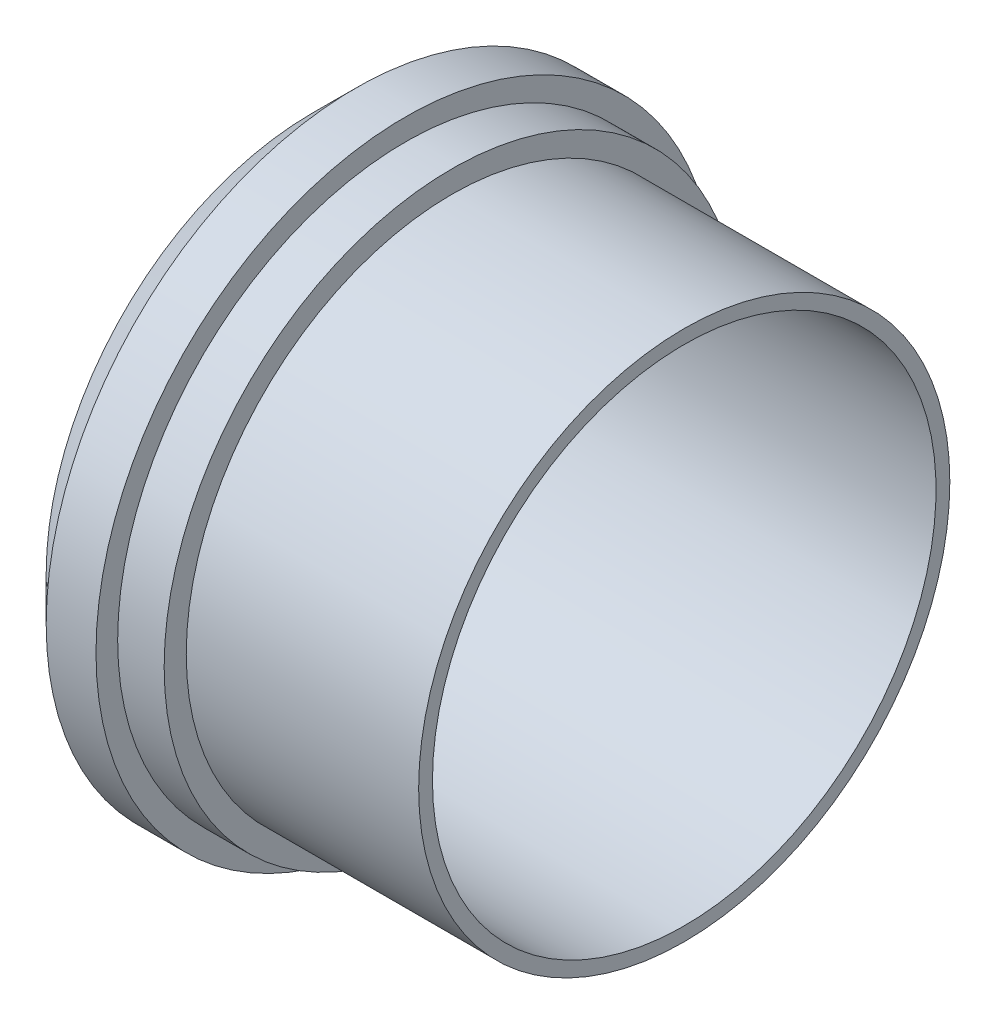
SolidWorks part; units mm, degrees
ref_plane "Front Plane" through (0, 0, 0) normal (0, 0, 1) x (1, 0, 0)
ref_plane "Top Plane" through (0, 0, 0) normal (0, 1, 0) x (1, 0, 0)
ref_plane "Right Plane" through (0, 0, 0) normal (1, 0, 0) x (0, 0, -1)
sketch "Sketch1" plane through (0, 0, 0) normal (0, 0, 1) x (1, 0, 0)
  line L0 (0, 0) -> (-27.78, 0)
  line L1 (-27.78, 0) -> (-27.78, -2.6416)
  line L2 (-27.78, -2.6416) -> (-33.3375, -2.6416)
  line L3 (-33.3375, -2.6416) -> (-33.3375, -5.2324)
  line L4 (-33.3375, -5.2324) -> (-39.2913, -5.2324)
  line L5 (-39.2913, -5.2324) -> (-44.45, -0.0762)
  line L6 (-44.45, -0.0762) -> (-44.45, 31.75)
  line L7 (-44.45, 31.75) -> (0, 31.75)
  line L8 (0, 31.75) -> (0, 0)
  dimension "D1" = 31.75
  dimension "D2" = 44.45
  dimension "D3" = 5.5575
  dimension "D4" = 5.9538
  dimension "D5" = 5.1587
  dimension "D6" = 31.8262
  dimension "D7" = 36.9824
  dimension "D8" = 34.3916
revolve "Revolve1" add sketch "Sketch1" angle 360 about L7
sketch "Sketch4" plane through (-44.45, 0, 0) normal (-1, 0, 0) x (0, 0, 1)
  circle A0 centre (0, 31.75) radius 30.099
extrude "Cut-Extrude1" cut sketch "Sketch4" against normal blind 44.45 contours A0
